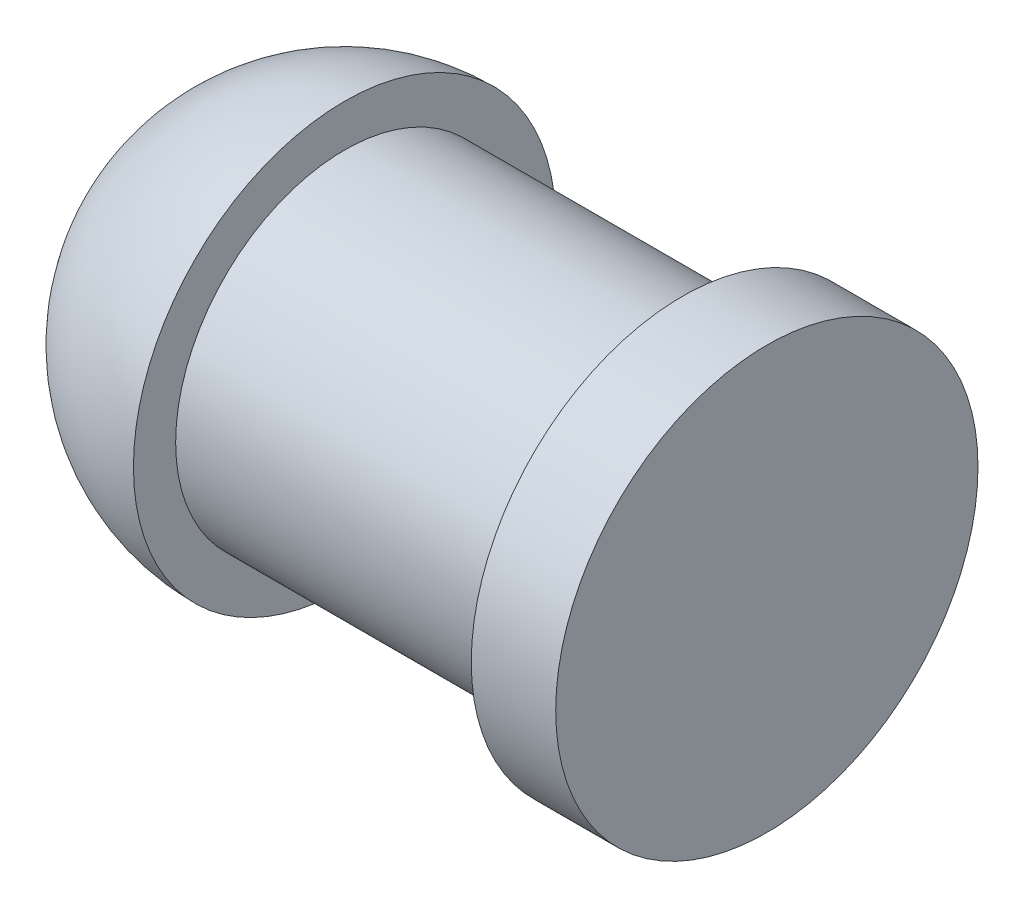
SolidWorks part; units mm, degrees
ref_plane "Plan1" through (0, 0, 0) normal (0, 0, 1) x (1, 0, 0)
ref_plane "Plan2" through (0, 0, 0) normal (0, 1, 0) x (1, 0, 0)
ref_plane "Plan3" through (0, 0, 0) normal (1, 0, 0) x (0, 0, -1)
sketch "Esquisse1" plane through (0, 0, 0) normal (0, 0, 1) x (1, 0, 0)
  line L0 (-60, 0) -> (90, 0) construction
  line L1 (0, 0) -> (0, 5)
  line L2 (0, 5) -> (-2, 5)
  line L3 (-2, 5) -> (-2, 4)
  line L4 (-2, 4) -> (-10, 4)
  line L5 (-10, 4) -> (-10, 5)
  line L6 (0, 0) -> (-15, 0)
  arc A0 (-10, 5) -> (-15, 0) centre (-10, 0) ccw
  dimension "D1" = 2
  dimension "D2" = 4
  dimension "D3" = 5
  dimension "D5" = 8
revolve "Base-Révolution" add sketch "Esquisse1" angle 360 about L0
